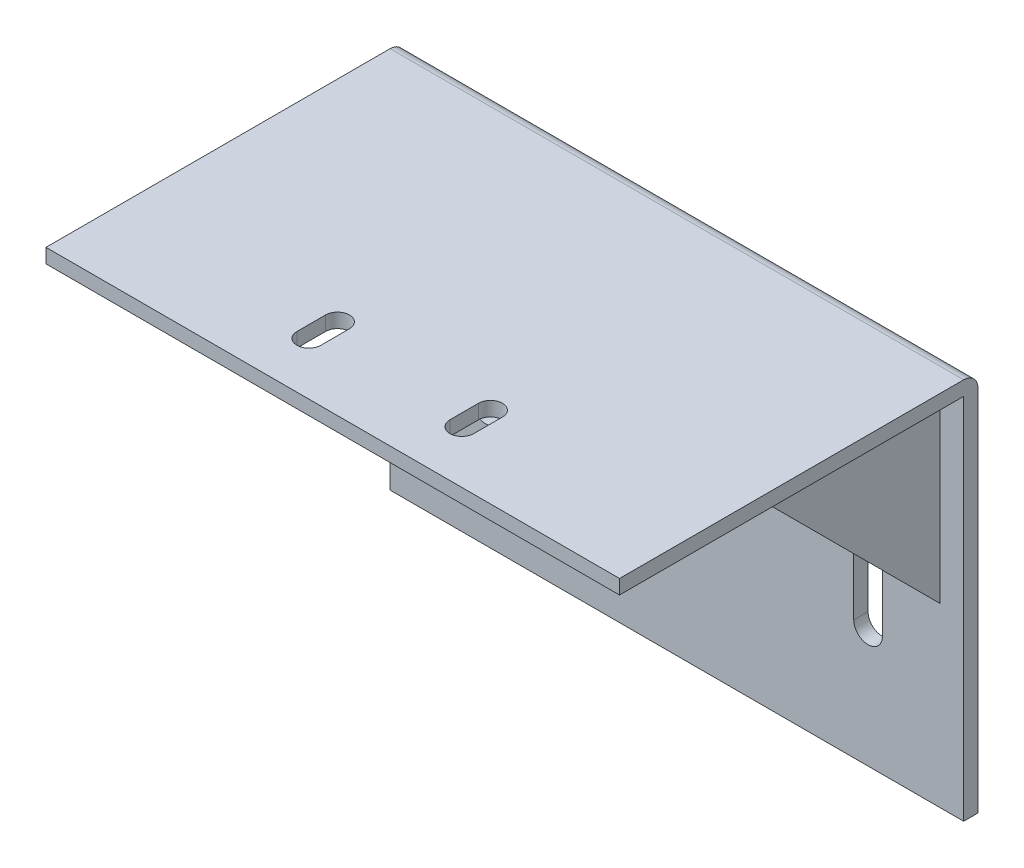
SolidWorks part; units mm, degrees
ref_plane "Plan1" through (0, 0, 0) normal (0, 0, 1) x (1, 0, 0)
ref_plane "Plan2" through (0, 0, 0) normal (0, 1, 0) x (1, 0, 0)
ref_plane "Plan3" through (0, 0, 0) normal (1, 0, 0) x (0, 0, -1)
sketch "Esquisse1" plane through (0, 0, 0) normal (0, 0, 1) x (1, 0, 0)
  line L1 (0, 0) -> (120, 0)
  line L2 (0, 0) -> (0, 80)
  line L3 (0, 80) -> (120, 80)
  line L4 (120, 0) -> (120, 80)
extrude "Base-Extrusion" add sketch "Esquisse1" along normal blind 3
sketch "Esquisse2" plane through (0, 0, 3) normal (0, 0, 1) x (1, 0, 0)
  line L0 (120, 0) -> (120, 80) construction
  line L1 (0, 80) -> (120, 80)
  line L2 (0, 80) -> (0, 77)
  line L3 (0, 77) -> (120, 77)
  line L4 (120, 80) -> (120, 77)
extrude "Boss.-Extru.1" add sketch "Esquisse2" along normal blind 72
sketch "Esquisse5" plane through (0, 0, 3) normal (0, 0, 1) x (1, 0, 0)
  line L4 (17, 55) -> (17, 25)
  line L5 (23, 55) -> (23, 25)
  line L6 (97, 55) -> (97, 25)
  line L7 (103, 55) -> (103, 25)
  arc A4 (17, 25) -> (23, 25) centre (20, 25) ccw
  arc A5 (23, 55) -> (17, 55) centre (20, 55) ccw
  arc A6 (97, 25) -> (103, 25) centre (100, 25) ccw
  arc A7 (103, 55) -> (97, 55) centre (100, 55) ccw
extrude "Enlèv. mat.-Extru.1" cut sketch "Esquisse5" against normal blind 3
sketch "Esquisse6" plane through (0, 0, 3) normal (0, 0, 1) x (1, 0, 0)
  line L9 (5, 77) -> (8, 77)
  line L10 (5, 77) -> (5, 37)
  line L11 (5, 37) -> (8, 37)
  line L12 (8, 77) -> (8, 37)
  line L13 (112, 77) -> (115, 77)
  line L14 (112, 77) -> (112, 37)
  line L15 (112, 37) -> (115, 37)
  line L16 (115, 77) -> (115, 37)
extrude "Boss.-Extru.2" add sketch "Esquisse6" along normal blind 40
sketch "Esquisse8" plane through (0, 77, 0) normal (0, -1, 0) x (1, 0, 0)
  line L0 (41.5, 64) -> (41.5, 58)
  line L1 (46.5, 64) -> (46.5, 58)
  line L2 (73.5, 64) -> (73.5, 58)
  line L3 (78.5, 64) -> (78.5, 58)
  arc A0 (46.5, 64) -> (41.5, 64) centre (44, 64) ccw
  arc A1 (73.5, 58) -> (78.5, 58) centre (76, 58) ccw
  arc A2 (41.5, 58) -> (46.5, 58) centre (44, 58) ccw
  arc A3 (78.5, 64) -> (73.5, 64) centre (76, 64) ccw
extrude "Enlèv. mat.-Extru.3" cut sketch "Esquisse8" against normal blind 3
sketch "Esquisse10" plane through (5, 0, 0) normal (-1, 0, 0) x (0, 0, 1)
  line L0 (3, 37) -> (43, 77)
  line L1 (3, 77) -> (3, 0) construction
  line L2 (75, 77) -> (3, 77) construction
  line L3 (43, 77) -> (43, 37)
  line L4 (43, 37) -> (3, 37)
extrude "Enlèv. mat.-Extru.5" cut sketch "Esquisse10" against normal through all
fillet "Congé1" radius 3
